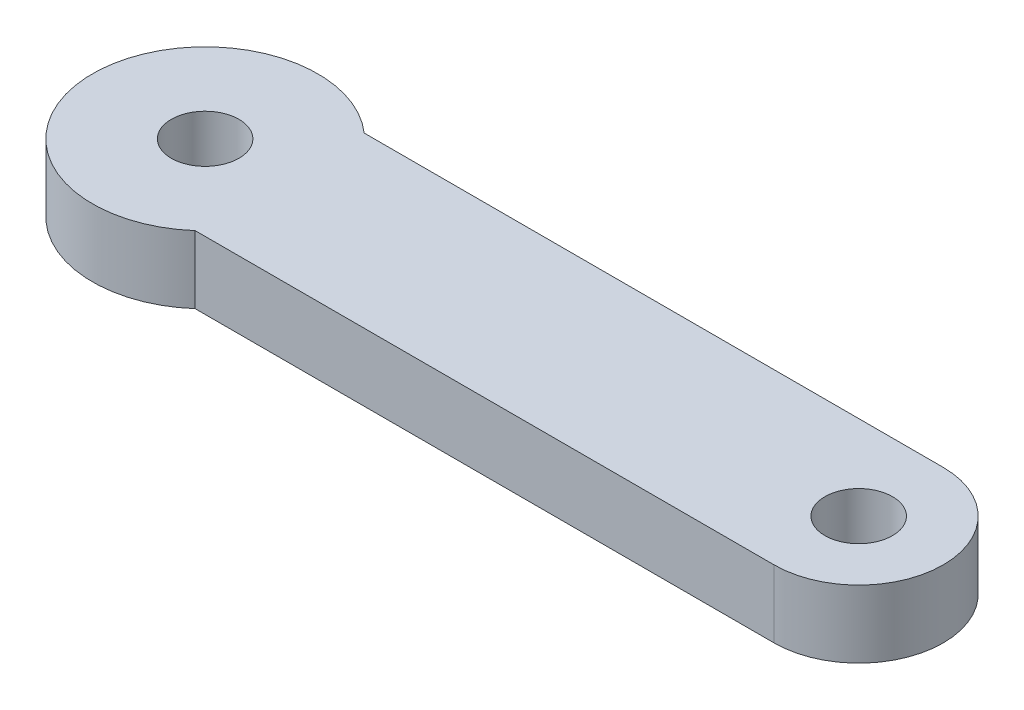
SolidWorks part; units mm, degrees
ref_plane "Face" through (0, 0, 0) normal (0, 0, 1) x (1, 0, 0)
ref_plane "Dessus" through (0, 0, 0) normal (0, 1, 0) x (1, 0, 0)
ref_plane "Droite" through (0, 0, 0) normal (1, 0, 0) x (0, 0, -1)
sketch "Esquisse1" plane through (0, 0, 0) normal (0, 1, 0) x (1, 0, 0)
  line L0 (-4.3314, 0) -> (113.3412, 0) construction
  line L1 (5.2287, 7.5) -> (109.1236, 7.5) construction
  line L2 (0, -20.2773) -> (0, 53.9333) construction
  line L3 (58, -20.2773) -> (58, 43.7073) construction
  line L4 (58, 7.5) -> (6.6144, 7.5)
  line L5 (58, -7.5) -> (6.6144, -7.5)
  circle A0 centre (0, 0) radius 3
  arc A1 (6.6144, 7.5) -> (6.6144, -7.5) centre (0, 0) ccw
  arc A2 (58, -7.5) -> (58, 7.5) centre (58, 0) ccw
  circle A3 centre (58, 0) radius 3
  dimension "D1" = 7.5
  dimension "D2" = 58
extrude "Extrusion1" add sketch "Esquisse1" along normal blind 6
